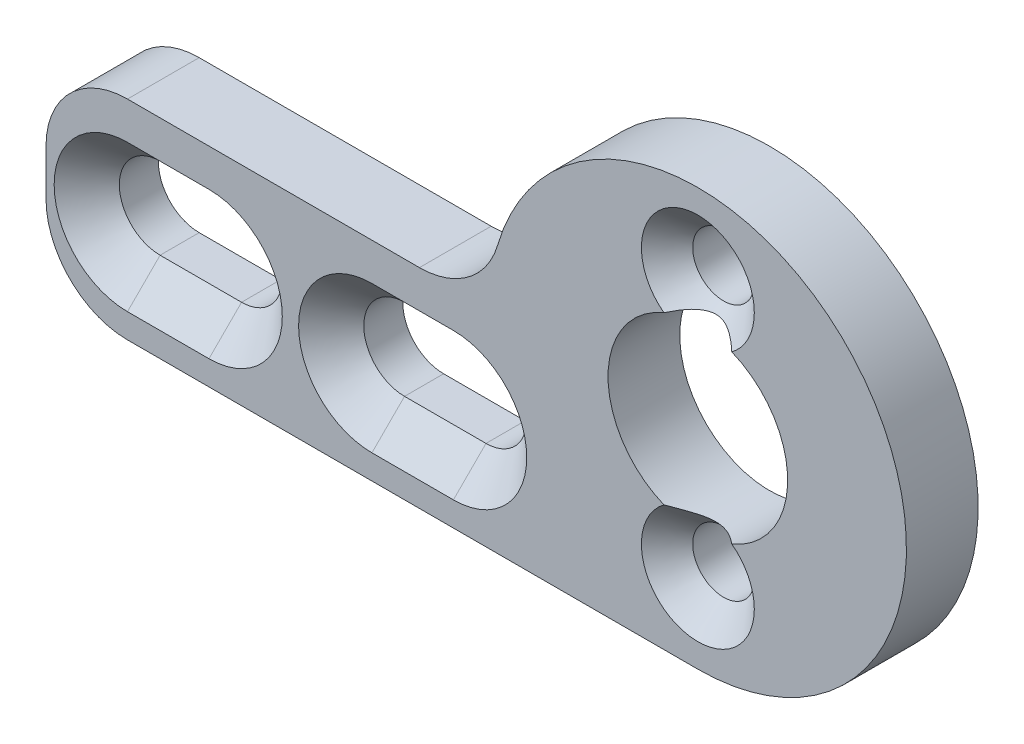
SolidWorks part; units mm, degrees
ref_plane "Front" through (0, 0, 0) normal (0, 0, 1) x (1, 0, 0)
ref_plane "Top" through (0, 0, 0) normal (0, 1, 0) x (1, 0, 0)
ref_plane "Right" through (0, 0, 0) normal (1, 0, 0) x (0, 0, -1)
sketch "Sketch1" plane through (0, 0, 0) normal (0, 0, 1) x (1, 0, 0)
  line L0 (0, -8.128) -> (-25.4, -8.128)
  line L1 (-25.4, -8.128) -> (-25.4, 0)
  line L2 (-25.4, 0) -> (-8.128, 0)
  circle A0 centre (0, 0) radius 3.5
  arc A1 (0, -8.128) -> (-8.128, 0) centre (0, 0) ccw
  dimension "D1" = 7
  dimension "D2" = 16.256
  dimension "D3" = 25.4
extrude "Extrude1" add sketch "Sketch1" along normal blind 2.794
hole_wizard "CSK for M2 Flat Head Machine Screw1" positions "Sketch3" profile "Sketch2" countersink size "M2" standard "Ansi Metric"
sketch "Sketch3" plane through (0, 0, 2.794) normal (0, 0, 1) x (1, 0, 0)
  line L0 (0, 0) -> (-5.0933, 0) construction
  point P0 (0, 5)
  point P7 (0, -5)
  dimension "D1" = 10
sketch "Sketch2" plane through (0, 5, 2.794) normal (1, 0, 0) x (0, -1, 0)
  line L0 (0, 0) -> (0, 2.794)
  line L1 (0, 2.794) -> (1.2, 2.794)
  line L2 (1.2, 2.794) -> (1.2, 1)
  line L3 (1.2, 1) -> (2.2, 0)
  line L5 (2.2, 0) -> (0, 0)
  line L6 (-1.2, 1) -> (-2.2, 0) construction
  line L11 (0, -6.35) -> (0, 107.95) construction
  dimension "Thru Hole Dia." = 2.4
  dimension "Thru Hole Depth" = 2.794
  dimension "Near C'Sink Dia." = 4.4
  dimension "Near C'Sink Angle" = 90
sketch "Sketch4" plane through (0, 0, 2.794) normal (0, 0, 1) x (1, 0, 0)
  line L0 (-23.2334, -4.318) -> (-6.3175, -4.318) construction
  line L1 (-22.225, -2.7305) -> (-19.05, -2.7305)
  line L2 (-19.05, -5.9055) -> (-22.225, -5.9055)
  arc A0 (-19.05, -2.7305) -> (-19.05, -5.9055) centre (-19.05, -4.318) cw
  arc A1 (-22.225, -5.9055) -> (-22.225, -2.7305) centre (-22.225, -4.318) cw
  dimension "D1" = 3.175
  dimension "D2" = 3.175
  dimension "D3" = 4.318
  dimension "D4" = 19.05
extrude "Cut-Extrude1" cut sketch "Sketch4" against normal through all
pattern_linear "LPattern1" count 2 spacing 9.525 along (1, 0, 0) of "Cut-Extrude1"
chamfer "Chamfer1" distance 1.27 angle 45 8 edges at (-23.8125, -4.318, 2.794) (-20.6375, -5.9055, 2.794) (-17.4625, -4.318, 2.794) (-20.6375, -2.7305, 2.794) (-14.2875, -4.318, 2.794) (-11.1125, -5.9055, 2.794) (-7.9375, -4.318, 2.794) (-11.1125, -2.7305, 2.794)
fillet "Fillet1" radius 3.175 3 edges at (-8.128, 0, 1.397) (-25.4, 0, 1.397) (-25.4, -8.128, 1.397)
